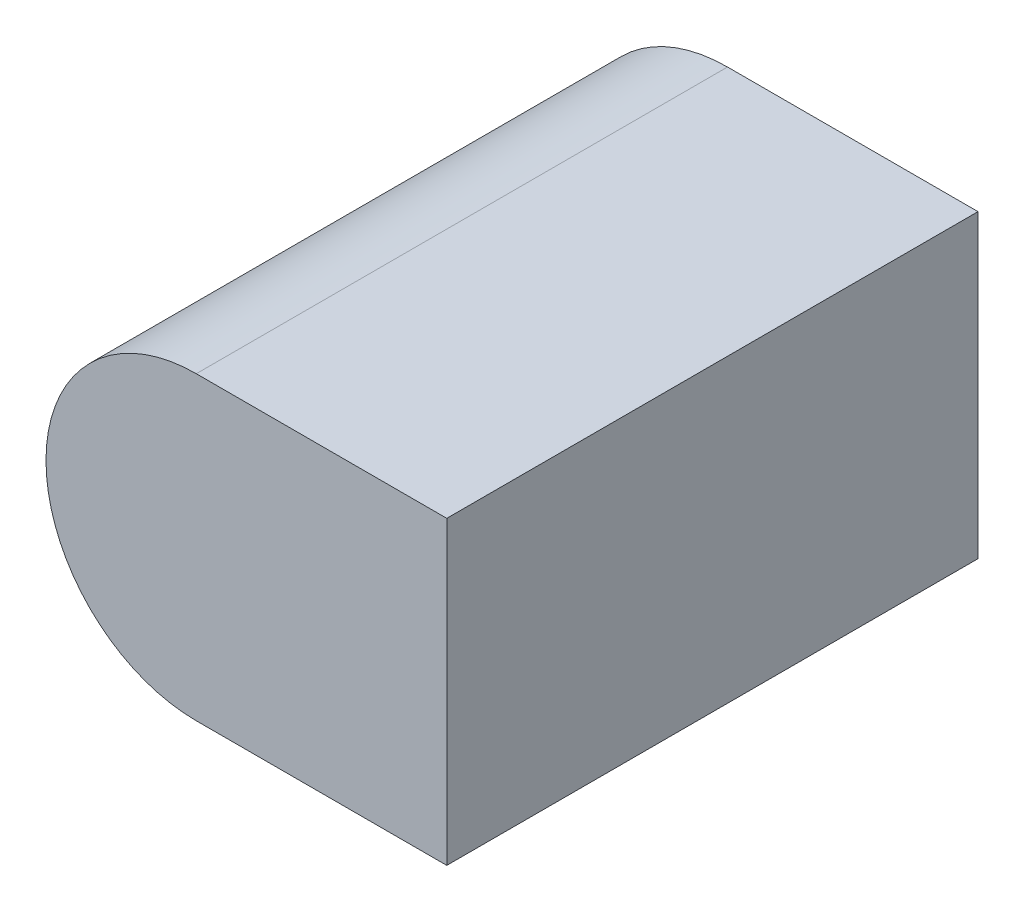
SolidWorks part; units mm, degrees
ref_plane "Front Plane" through (0, 0, 0) normal (0, 0, 1) x (1, 0, 0)
ref_plane "Top Plane" through (0, 0, 0) normal (0, 1, 0) x (1, 0, 0)
ref_plane "Right Plane" through (0, 0, 0) normal (1, 0, 0) x (0, 0, -1)
body saved out of another part "Stock-Multibody - Splitting-1"
